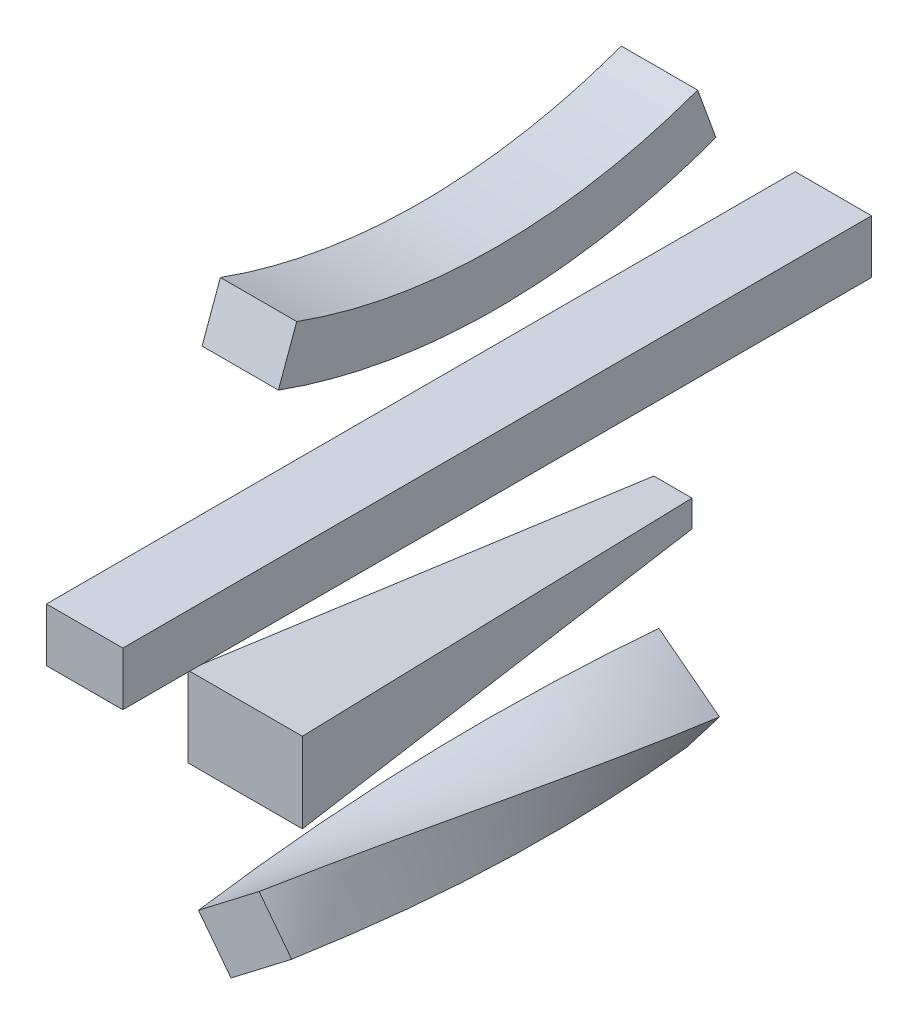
SolidWorks part; units mm, degrees
ref_plane "Front Plane" through (0, 0, 0) normal (0, 0, 1) x (1, 0, 0)
ref_plane "Top Plane" through (0, 0, 0) normal (0, 1, 0) x (1, 0, 0)
ref_plane "Right Plane" through (0, 0, 0) normal (1, 0, 0) x (0, 0, -1)
sketch "Sketch1" plane through (0, 0, 0) normal (0, 0, 1) x (1, 0, 0)
  line L0 (0, 10.5816) -> (0, 35.9816) construction
  line L1 (0, 35.9816) -> (18.134, 35.9816)
  line L2 (0, 35.9816) -> (0, 48.6816)
  line L3 (0, 48.6816) -> (18.134, 48.6816)
  line L4 (18.134, 35.9816) -> (18.134, 48.6816)
  line L5 (0, -2.1184) -> (18.134, -2.1184)
  line L6 (0, -2.1184) -> (0, 10.5816)
  line L7 (0, 10.5816) -> (18.134, 10.5816)
  line L8 (18.134, -2.1184) -> (18.134, 10.5816)
  line L9 (0, -40.2184) -> (18.134, -40.2184)
  line L10 (0, -40.2184) -> (0, -27.5184)
  line L11 (0, -27.5184) -> (18.134, -27.5184)
  line L12 (18.134, -40.2184) -> (18.134, -27.5184)
  line L13 (0, -78.3184) -> (18.134, -78.3184)
  line L14 (0, -78.3184) -> (0, -65.6184)
  line L15 (0, -65.6184) -> (18.134, -65.6184)
  line L16 (18.134, -78.3184) -> (18.134, -65.6184)
  line L17 (0, -27.5184) -> (0, -2.1184) construction
  line L18 (0, -65.6184) -> (0, -40.2184) construction
  dimension "D1" = 12.7
  dimension "D2" = 25.4
extrude "Extrude1" add sketch "Sketch1" along normal mid plane 101.6
other "Flex1" parameters "D0"=40, "D1"=0, "D2"=0
other "Flex2" parameters "D0"=76.2, "D1"=0, "D2"=0
other "Flex3" parameters "D0"=57.296, "D1"=0, "D2"=0
other "Flex4" parameters "D0"=75, "D1"=0, "D2"=0
